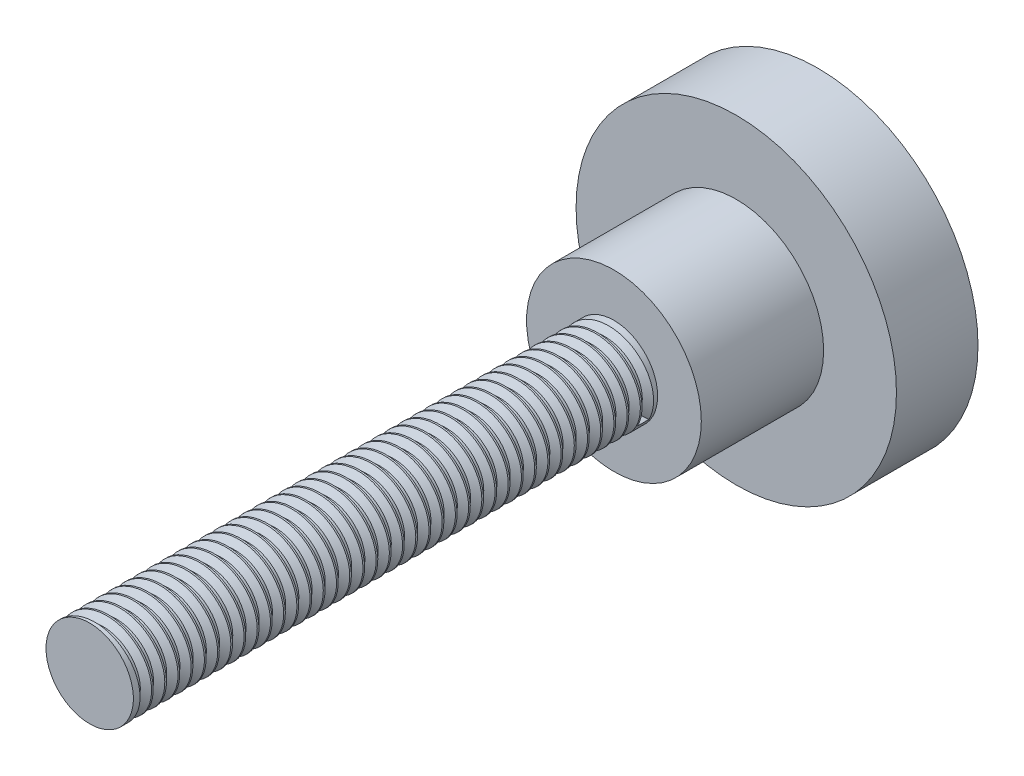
SolidWorks part; units mm, degrees
ref_plane "前视基准面" through (0, 0, 0) normal (0, 0, 1) x (1, 0, 0)
ref_plane "上视基准面" through (0, 0, 0) normal (0, 1, 0) x (1, 0, 0)
ref_plane "右视基准面" through (0, 0, 0) normal (1, 0, 0) x (0, 0, -1)
sketch "草图1" plane through (0, 0, 0) normal (0, 0, 1) x (1, 0, 0)
  circle A0 centre (0, 0) radius 3
  dimension "D1" = 6
extrude "凸台-拉伸1" add sketch "草图1" along normal blind 4.2
sketch "草图2" plane through (0, 0, 4.2) normal (0, 0, 1) x (1, 0, 0)
  circle A0 centre (0, 0) radius 1.5
  dimension "D1" = 3
extrude "凸台-拉伸2" add sketch "草图2" along normal blind 18
sketch "草图3" plane through (0, 0, 0) normal (0, 0, -1) x (-1, 0, 0)
  line L1 (1.1762, -1.2714) -> (1.6892, 0.3829)
  line L2 (1.6892, 0.3829) -> (0.513, 1.6543)
  line L3 (0.513, 1.6543) -> (-1.1762, 1.2714)
  line L4 (-1.1762, 1.2714) -> (-1.6892, -0.3829)
  line L5 (-1.6892, -0.3829) -> (-0.513, -1.6543)
  line L6 (-0.513, -1.6543) -> (1.1762, -1.2714)
  circle A0 centre (0, 0) radius 1.5 construction
  dimension "D1" = 3
thread "螺纹线1" pitch 0.4536 start angle 0, offset 0, length 17.5, pitch 0.4536, diameter 3
ref_plane "基准面4" through (-1.5, 0, 22.2) normal (0, -1, 0) x (-1, 0, 0)
sketch "螺纹线轮廓1" plane through (-1.5, 0, 22.2) normal (0, -1, 0) x (-1, 0, 0)
  line L0 (0, 0) -> (0, 0.4536) construction
  line L11 (0, 0) -> (0, 0.3969)
  line L12 (0, 0.3969) -> (-0.2455, 0.2551)
  line L13 (-0.2455, 0.2551) -> (-0.2455, 0.1417)
  line L15 (-0.2455, 0.1417) -> (0, 0)
  line L17 (-0.2455, 0.1984) -> (0, 0.1984) construction
  point P2 (0, 0)
  dimension "Pitch" = 0.4536
  dimension "Profile_Angle" = 60
  dimension "Profile_Land" = 0.1134
  dimension "Profile_Height" = 0.2455
sketch "草图4" plane through (0, 0, 0) normal (0, 0, -1) x (-1, 0, 0)
  circle A0 centre (0, 0) radius 5.5
  dimension "D1" = 11
extrude "凸台-拉伸3" add sketch "草图4" along normal blind 2.8
